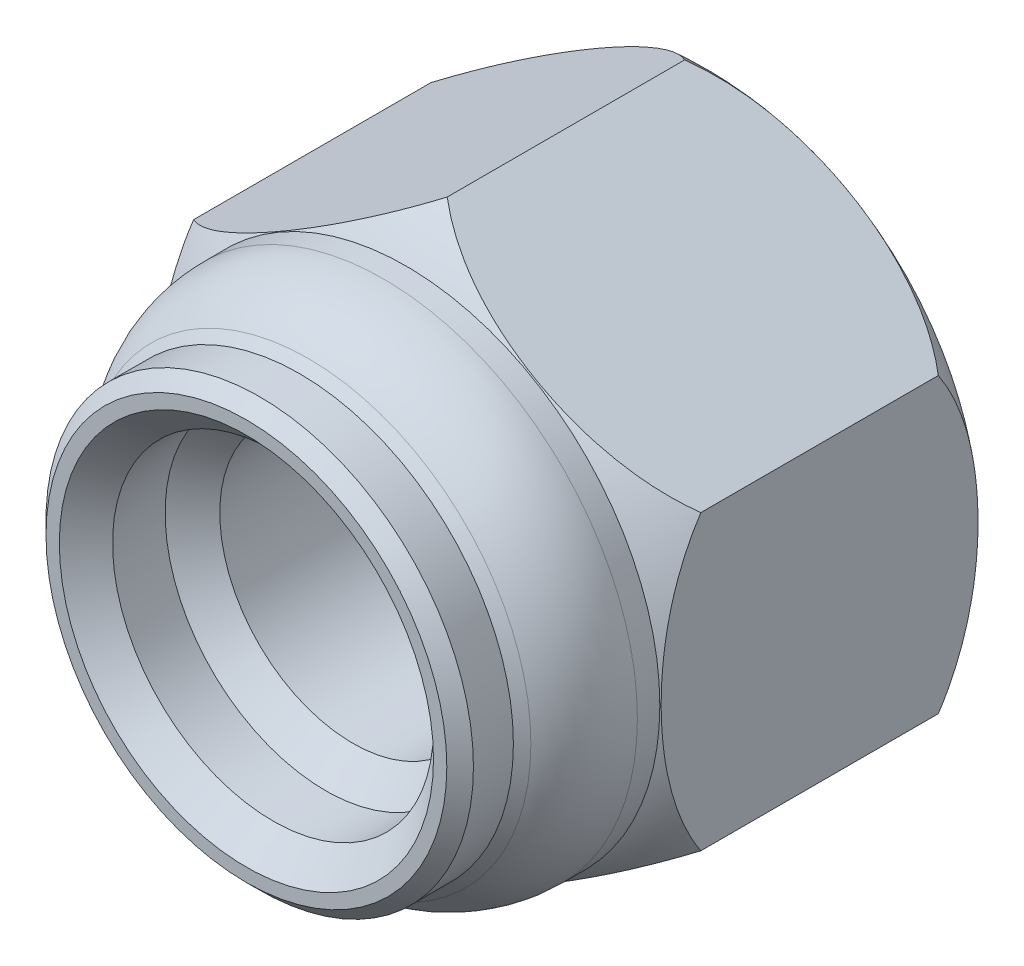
SolidWorks part; units mm, degrees
ref_plane "Front Plane" through (0, 0, 0) normal (0, 0, 1) x (1, 0, 0)
ref_plane "Top Plane" through (0, 0, 0) normal (0, 1, 0) x (1, 0, 0)
ref_plane "Right Plane" through (0, 0, 0) normal (1, 0, 0) x (0, 0, -1)
sketch "Sketch1" plane through (0, 0, 0) normal (0, 0, 1) x (1, 0, 0)
  line L1 (4.7631, -2.75) -> (4.7631, 2.75)
  line L2 (4.7631, 2.75) -> (0, 5.5)
  line L3 (0, 5.5) -> (-4.7631, 2.75)
  line L4 (-4.7631, 2.75) -> (-4.7631, -2.75)
  line L5 (-4.7631, -2.75) -> (0, -5.5)
  line L6 (0, -5.5) -> (4.7631, -2.75)
  circle A0 centre (0, 0) radius 4.7631 construction
  circle A1 centre (0, 0) radius 2
  dimension "D2" = 4
  dimension "D1" = 5.5
extrude "Boss-Extrude1" add sketch "Sketch1" along normal blind 6
sketch "Sketch3" plane through (0, 0, 0) normal (1, 0, 0) x (0, 0, -1)
  line L0 (-6.75, 2.25) -> (-6.75, 6.25)
  line L1 (-6.75, 6.25) -> (-2.75, 6.25)
  line L4 (-6, 5.5) -> (0, 5.5) construction
  line L5 (-6, 2.75) -> (-6, 5.5) construction
  line L6 (-3, -5.5) -> (-3, 5.5) construction
  line L7 (-6, -5.5) -> (0, -5.5) construction
  line L8 (0, 0) -> (-6, 0) construction
  line L9 (-6, -2.75) -> (-6, 2.75) construction
  line L10 (0.75, 2.25) -> (0.75, 6.25)
  line L11 (0.75, 6.25) -> (-3.25, 6.25)
  arc A0 (-6.75, 2.25) -> (-2.75, 6.25) centre (-2.9556, 2.4556) cw
  arc A1 (0.75, 2.25) -> (-3.25, 6.25) centre (-3.0444, 2.4556) ccw
  dimension "D2" = 3.8
  dimension "D3" = 0.75
  dimension "D1" = 4
  dimension "D4" = 0.75
revolve "Cut-Revolve1" cut sketch "Sketch3" angle 360 about L8
sketch "Sketch4" plane through (0, 0, 6) normal (0, 0, 1) x (1, 0, 0)
  line L1 (-4.7631, 2.75) -> (-4.7631, -2.75) construction
  circle A0 centre (0, 0) radius 4.7631
extrude "Boss-Extrude2" add sketch "Sketch4" along normal blind 2
chamfer "Chamfer1" distance 0.75 angle 45 1 edges at (4.7631, 0, 8)
sketch "Sketch6" plane through (0, 0, 8) normal (0, 0, 1) x (1, 0, 0)
  circle A1 centre (0, 0) radius 4.0131
  circle A2 centre (0, 0) radius 4.0131 construction
  circle A3 centre (0, 0) radius 3.0131
  dimension "D1" = 1
extrude "Boss-Extrude3" add sketch "Sketch6" along normal blind 1
chamfer "Chamfer2" distance 0.5 angle 45 1 edges at (3.0131, 0, 9)
chamfer "Chamfer3" distance 0.25 angle 45 1 edges at (4.0131, 0, 9)
fillet "Fillet1" radius 2 1 edges at (4.7631, 0, 7.25)
sketch "Sketch7" plane through (0, 0, 8) normal (0, 0, 1) x (1, 0, 0)
  circle A1 centre (0, 0) radius 3.0131 construction
  circle A2 centre (0, 0) radius 2.5
  dimension "D1" = 5
extrude "Cut-Extrude2" cut sketch "Sketch7" against normal up to surface and the other way through all
chamfer "Chamfer4" distance 1 angle 45 1 edges at (2.5, 0, 8)
